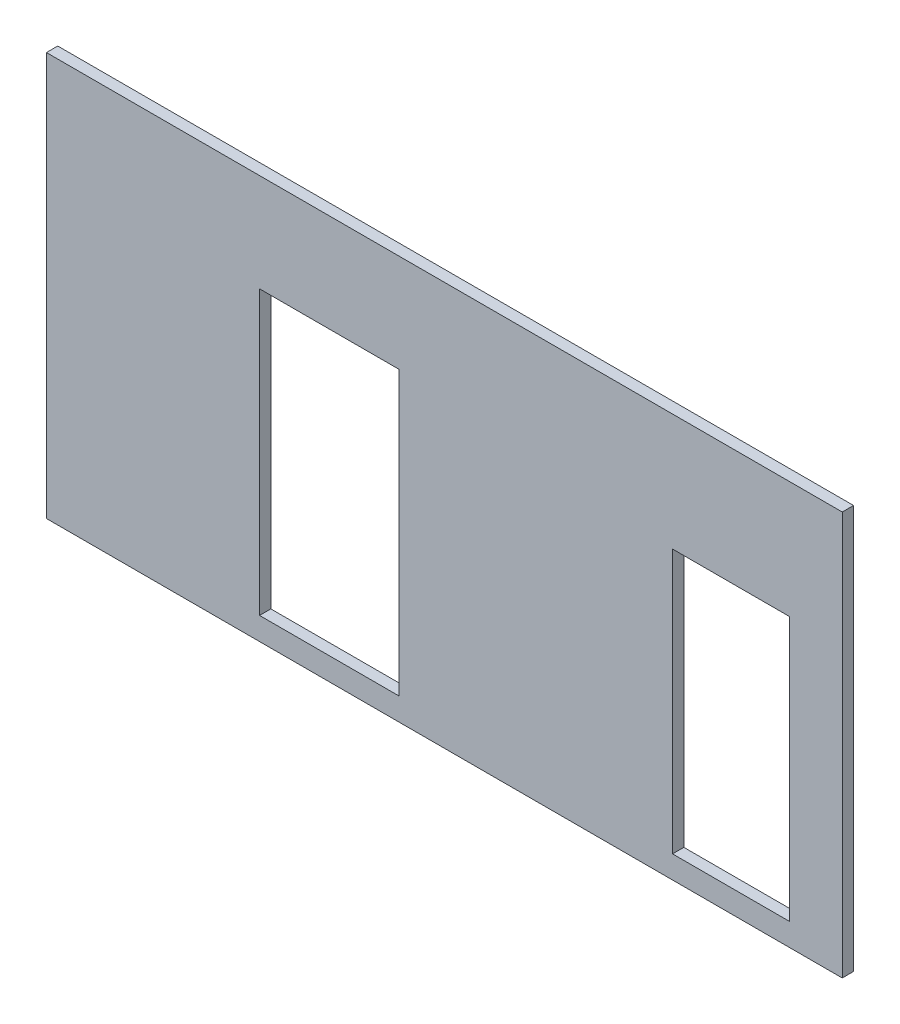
SolidWorks part; units mm, degrees
ref_plane "Plan de face" through (0, 0, 0) normal (0, 0, 1) x (1, 0, 0)
ref_plane "Plan de dessus" through (0, 0, 0) normal (0, 1, 0) x (1, 0, 0)
ref_plane "Plan de droite" through (0, 0, 0) normal (1, 0, 0) x (0, 0, -1)
sketch "Esquisse1" plane through (0, 0, 0) normal (0, 0, 1) x (1, 0, 0)
  line L1 (0, 0) -> (211, 0)
  line L2 (0, 0) -> (0, 107)
  line L3 (0, 107) -> (211, 107)
  line L4 (211, 0) -> (211, 107)
  dimension "D1" = 211
  dimension "D2" = 107
extrude "Extrusion1" add sketch "Esquisse1" along normal blind 3
sketch "Esquisse2" plane through (0, 0, 3) normal (0, 0, 1) x (1, 0, 0)
  line L0 (0, 107) -> (0, 0) construction
  line L1 (56.5, 6) -> (93.5, 6)
  line L2 (56.5, 6) -> (56.5, 81)
  line L3 (56.5, 81) -> (93.5, 81)
  line L4 (93.5, 6) -> (93.5, 81)
  line L5 (166, 6) -> (197, 6)
  line L6 (166, 6) -> (166, 76)
  line L7 (166, 76) -> (197, 76)
  line L8 (197, 6) -> (197, 76)
  line L9 (0, 0) -> (211, 0) construction
  line L10 (211, 0) -> (211, 107) construction
  dimension "D1" = 75
  dimension "D2" = 37
  dimension "D3" = 56.5
  dimension "D4" = 6
  dimension "D5" = 31
  dimension "D6" = 70
  dimension "D7" = 6
  dimension "D8" = 14
extrude "Enlèv. mat.-Extru.1" cut sketch "Esquisse2" against normal blind 3
